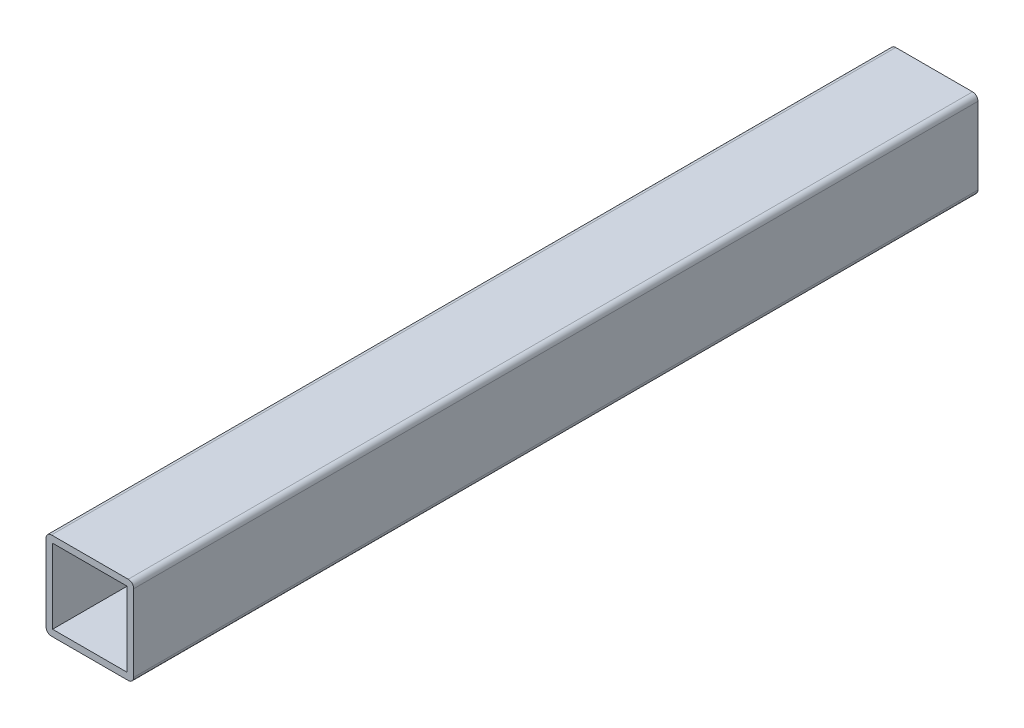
SolidWorks part; units mm, degrees
ref_plane "Plan de face" through (0, 0, 0) normal (0, 0, 1) x (1, 0, 0)
ref_plane "Plan de dessus" through (0, 0, 0) normal (0, 1, 0) x (1, 0, 0)
ref_plane "Plan de droite" through (0, 0, 0) normal (1, 0, 0) x (0, 0, -1)
sketch "Esquisse1" plane through (0, 0, 0) normal (0, 0, 1) x (1, 0, 0)
  line L1 (0, 0) -> (80, 0)
  line L2 (0, 0) -> (0, -80)
  line L3 (0, -80) -> (80, -80)
  line L4 (80, 0) -> (80, -80)
  dimension "D1" = 80
  dimension "D2" = 80
extrude "Extru.-Mince1" add sketch "Esquisse1" along normal blind 770 thin
fillet "Congé1" radius 5 4 edges at (0, -80, 385) (80, -80, 385) (80, 0, 385) (0, 0, 385)
